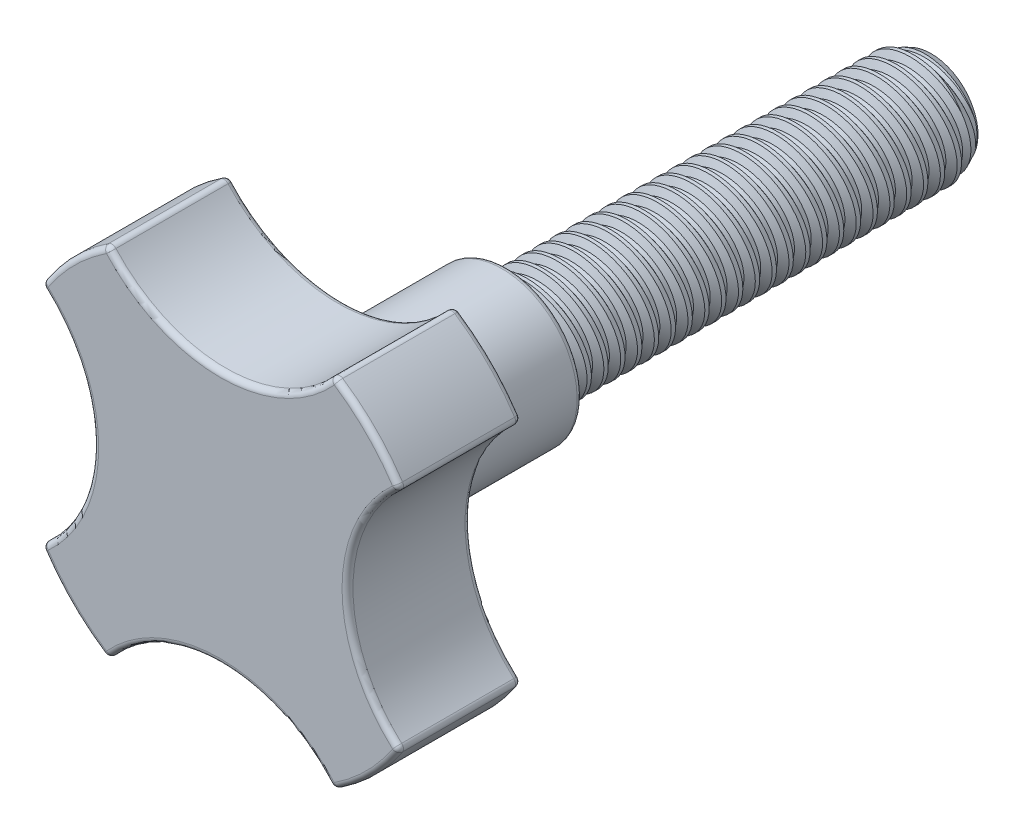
SolidWorks part; units mm, degrees
ref_plane "Front" through (0, 0, 0) normal (0, 0, 1) x (1, 0, 0)
ref_plane "Top" through (0, 0, 0) normal (0, 1, 0) x (1, 0, 0)
ref_plane "Right" through (0, 0, 0) normal (1, 0, 0) x (0, 0, -1)
sketch "Sketch1" plane through (0, 0, 0) normal (1, 0, 0) x (0, 0, -1)
  line L0 (24.6062, 0) -> (-24.6062, 0)
  line L1 (-24.6063, 6.35) -> (-24.6062, 4.5339) construction
  line L4 (-24.6063, 6.35) -> (24.6063, 6.35)
  line L5 (24.6063, 6.35) -> (24.6062, 0)
  line L6 (-24.6062, 0) -> (-24.6063, 6.35)
  line L7 (-8.5598, 0) -> (-24.6062, 0) construction
  line L10 (-24.6063, -6.35) -> (24.6063, -6.35) construction
  dimension "Screw Dia" = 12.7
  dimension "Thread Length" = 49.2125
revolve "Revolve1" add sketch "Sketch1" angle 360 about L7
sketch "Sketch2" plane through (0, 0, 0) normal (1, 0, 0) x (0, 0, -1)
  line L0 (-24.6062, 6.35) -> (-24.6062, -6.35) construction
  line L1 (-24.6062, -6.35) -> (-22.6524, -6.35) construction
  line L2 (-22.6524, -6.35) -> (-24.6062, 6.35) construction
  line L3 (-24.6062, 6.35) -> (-24.3649, 6.3871) construction
  line L4 (-24.3649, 6.3871) -> (-22.6751, 6.6471)
  line L5 (-22.6751, 6.6471) -> (-23.1178, 5.509)
  line L6 (-23.1178, 5.509) -> (-23.6006, 5.4347)
  line L7 (-23.6006, 5.4347) -> (-24.3649, 6.3871)
  line L8 (-23.3592, 5.4719) -> (-23.52, 6.5171) construction
  line L9 (-24.6062, 6.35) -> (-23.4943, 6.35) construction
  line L10 (-23.4943, 6.35) -> (-21.5404, -6.35) construction
  line L11 (-21.5404, -6.35) -> (-22.6524, -6.35) construction
  line L12 (-24.6063, -6.35) -> (24.6063, -6.35) construction
  line L13 (-24.6063, 6.35) -> (24.6063, 6.35) construction
  line L14 (-24.6062, 0) -> (-24.6062, 6.35) construction
  line L15 (-24.6062, -0.3214) -> (-20.4285, 0.3214) construction
  point P19 (-22.5174, 0)
  dimension "D1" = 0.2442
  dimension "D2" = 0.4885
  dimension "D3" = 60
  dimension "Thread Pitch" = 1.9538
  dimension "D4" = 1.9538
revolve "Cut-Revolve1" cut sketch "Sketch2" angle 360 about L15
sketch "Sketch3" plane through (0, 0, 0) normal (1, 0, 0) x (0, 0, -1)
  line L0 (22.6434, 6.35) -> (24.6063, 6.35)
  line L1 (24.6063, 6.35) -> (24.6063, 5.4347)
  line L2 (24.6063, 5.4347) -> (22.6434, 6.35)
  line L3 (-24.6063, 6.35) -> (24.6063, 6.35) construction
  line L4 (-8.5598, 0) -> (-24.6062, 0) construction
  line L5 (-8.5598, 0) -> (-24.6062, 0) construction
  line L6 (24.6063, 6.35) -> (24.6063, 0) construction
  line L7 (-23.6006, 5.4347) -> (24.6063, 5.4347) construction
  line L8 (22.6434, 6.35) -> (22.6434, -6.35) construction
  line L9 (-24.6063, -6.35) -> (24.6063, -6.35) construction
  dimension "D1" = 25
  dimension "D2" = 49.2125
  dimension "D3" = 12.7
revolve "Cut-Revolve2" cut sketch "Sketch3" angle 360 about L5
pattern_linear "LPattern1" count 25 spacing 1.9538 along (0, 0, -1) count 2 spacing 1.9538 along (0, 0, 1) of "Cut-Revolve1"
sketch "Sketch5" plane through (0, 0, 0) normal (1, 0, 0) x (0, 0, -1)
  line L0 (-57.9438, 0) -> (-24.6063, 0) construction
  line L1 (-24.6063, 0) -> (-24.6063, 8.7312)
  line L2 (-24.6063, 8.7312) -> (-43.6563, 8.7312)
  line L3 (-43.6563, 8.7312) -> (-43.6563, 24.6062)
  line L4 (-24.6063, 0) -> (-24.6063, -8.7312) construction
  line L5 (-24.6063, 0) -> (-57.9438, 0)
  line L8 (-57.9438, 0) -> (-57.9438, 8.7312)
  line L12 (-57.9438, 24.6062) -> (-43.6563, 24.6062)
  line L13 (-57.9438, 24.6062) -> (-57.9438, 8.7312)
  line L14 (-43.6563, -8.7312) -> (-43.6563, -24.6062) construction
  dimension "D1" = 8.7312
  dimension "D" = 19.05
  dimension "B" = 17.4625
  dimension "D2" = 24.6062
  dimension "C" = 14.2875
  dimension "A" = 49.2125
revolve "Revolve3" add sketch "Sketch5" angle 360 about L0
sketch "Sketch6" plane through (0, 0, 57.9438) normal (0, 0, 1) x (1, 0, 0)
  line L0 (0, 0) -> (0, 31.9881) construction
  line L1 (0, 0) -> (31.9881, 0) construction
  line L4 (0, 31.9881) -> (0, 14.7638)
  line L5 (14.7637, 0) -> (31.9881, 0)
  circle A0 centre (0, 0) radius 24.6063 construction
  arc A1 (20.8207, 13.1136) -> (13.1136, 20.8207) centre (0, 0) ccw
  arc A2 (0, 14.7638) -> (13.1136, 20.8207) centre (0, 31.9881) ccw
  arc A3 (14.7637, 0) -> (20.8207, 13.1136) centre (31.9881, 0) cw
  arc A4 (31.9881, 0) -> (0, 31.9881) centre (0, 0) ccw
  circle A5 centre (0, 0) radius 14.7637 construction
  circle A6 centre (0, 0) radius 24.6063 construction
  dimension "D2" = 29.5275
  dimension "D3" = 17.2244
  dimension "D1" = 90
extrude "Cut-Extrude1" cut sketch "Sketch6" against normal through all
fillet "Fillet4" radius 0.635 2 edges at (20.8207, 13.1136, 50.8) (13.1136, 20.8207, 50.8)
pattern_circular "CirPattern2" count 4 over 360 about axis through (0, 0, 0) along (0, 0, 1) of "Cut-Extrude1", "Fillet4"
fillet "Fillet5" radius 0.635 33 edges at (0, -8.7312, 24.6063) (14.7637, 0, 57.9438) (14.7637, 0, 43.6563) (17.3992, 17.3992, 57.9438) (13.1501, 20.6204, 57.9438) (20.6204, 13.1501, 57.9438) (17.3992, 17.3992, 43.6563) (13.1501, 20.6204, 43.6563) (20.6204, 13.1501, 43.6563) (0, 14.7637, 57.9438) (0, 14.7637, 43.6563) (-17.3992, 17.3992, 57.9438) (-20.6204, 13.1501, 57.9438) (-13.1501, 20.6204, 57.9438) (-17.3992, 17.3992, 43.6563) (-20.6204, 13.1501, 43.6563) (-13.1501, 20.6204, 43.6563) (-14.7637, 0, 57.9438) (-14.7637, 0, 43.6563) (-17.3992, -17.3992, 57.9438) (-13.1501, -20.6204, 57.9438) (-20.6204, -13.1501, 57.9438) (-17.3992, -17.3992, 43.6563) (-13.1501, -20.6204, 43.6563) (-20.6204, -13.1501, 43.6563) (0, -14.7637, 57.9438) (0, -14.7637, 43.6563) (17.3992, -17.3992, 57.9438) (20.6204, -13.1501, 57.9438) (13.1501, -20.6204, 57.9438) (17.3992, -17.3992, 43.6563) (20.6204, -13.1501, 43.6563) (13.1501, -20.6204, 43.6563)
equation "\"D1@Sketch2\"=\"Thread Pitch@Sketch2\"/8"
equation "\"D2@Sketch2\"=\"Thread Pitch@Sketch2\"/4"
equation "\"D4@Sketch2\"=\"Thread Pitch@Sketch2\""
equation "\"D3@LPattern1\"=\"Thread Pitch@Sketch2\""
equation "\"D4@LPattern1\"=\"Thread Pitch@Sketch2\""
equation "\"D1@LPattern1\"=\"Thread Length@Sketch1\"/\"Thread Pitch@Sketch2\""
equation "\"D1@Sketch5\" = \"B@Sketch5\"/2"
equation "\"D2@Sketch5\" = \"A@Sketch5\"/2"
equation "\"D2@Sketch6\" = \"A@Sketch5\"*.6"
equation "\"D3@Sketch6\" = \"A@Sketch5\"*.35"
